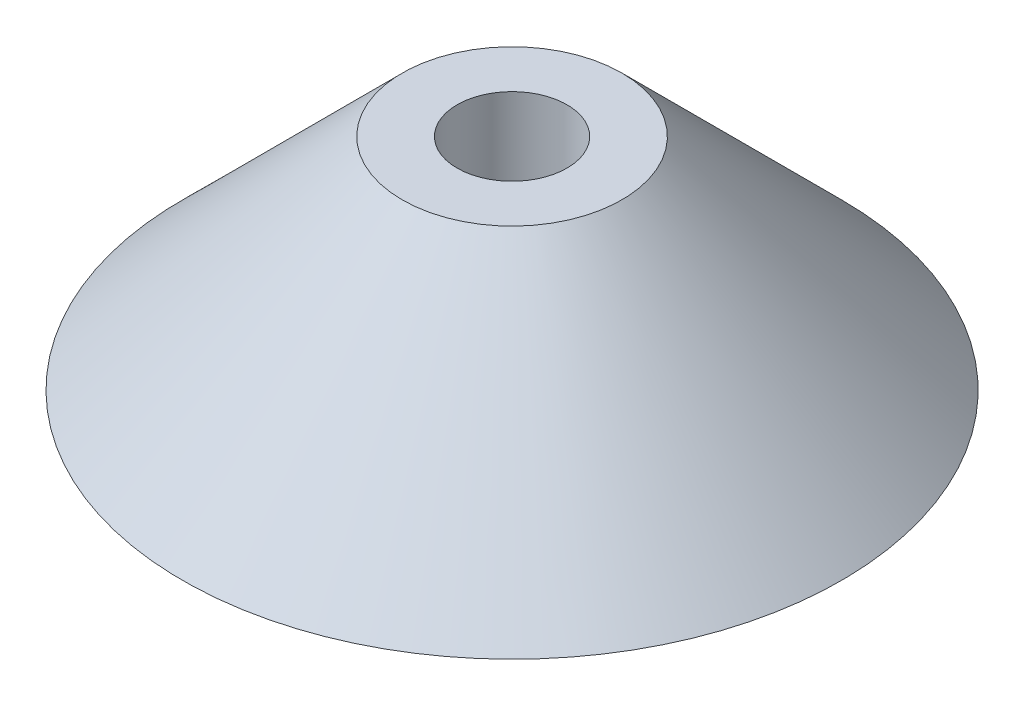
SolidWorks part; units mm, degrees
ref_plane "Ebene vorne" through (0, 0, 0) normal (0, 0, 1) x (1, 0, 0)
ref_plane "Ebene oben" through (0, 0, 0) normal (0, 1, 0) x (1, 0, 0)
ref_plane "Ebene rechts" through (0, 0, 0) normal (1, 0, 0) x (0, 0, -1)
sketch "Skizze1" plane through (0, 0, 0) normal (0, 0, 1) x (1, 0, 0)
  line L0 (0, 0) -> (0, -50000) construction
  line L1 (0, 0) -> (-30, 0)
  line L2 (-30, 0) -> (-10, 20)
  line L3 (0, 20) -> (0, 0)
  line L4 (0, 20) -> (-10, 20)
  line L5 (-19.7487, 10.2513) -> (-1.115, 10.2513) construction
  line L6 (0, 20) -> (0, 50) construction
  line L7 (0, 35) -> (23.5217, 35) construction
  circle A0 centre (-44.4975, 35) radius 35 construction
  point P9 (-19.7487, 10.2513)
  dimension "D2" = 70
  dimension "D1" = 45
  dimension "D3" = 30
  dimension "D4" = 20
  dimension "D5" = 30
  dimension "D6" = 24.7487
revolve "Rotation1" add sketch "Skizze1" angle 360 about L0
hole_wizard "Ø10.0 (10) Durchmesser Bohrung1" positions "Skizze3" profile "Skizze2" hole size "Ø10.0" standard "ISO"
sketch "Skizze3" plane through (0, 20, 0) normal (0, 1, 0) x (1, 0, 0)
  point P2 (0, 0)
sketch "Skizze2" plane through (0, 20, 0) normal (1, 0, 0) x (0, 0, 1)
  line L0 (0, 0) -> (0, 20)
  line L1 (0, 20) -> (5, 20)
  line L2 (5, 20) -> (5, 0)
  line L5 (5, 0) -> (0, 0)
  line L11 (0, -6.35) -> (0, 107.95) construction
  dimension "Bohrerdurchmesser" = 10
  dimension "Bohrungstiefe" = 20
ref_plane "Ebene1" through (0, 10.2513, 0) normal (0, 1, 0) x (1, 0, 0)
sketch "Teilkreis" plane through (0, 10.2513, 0) normal (0, 1, 0) x (1, 0, 0)
  circle A0 centre (-1.115, 0) radius 18.6337
